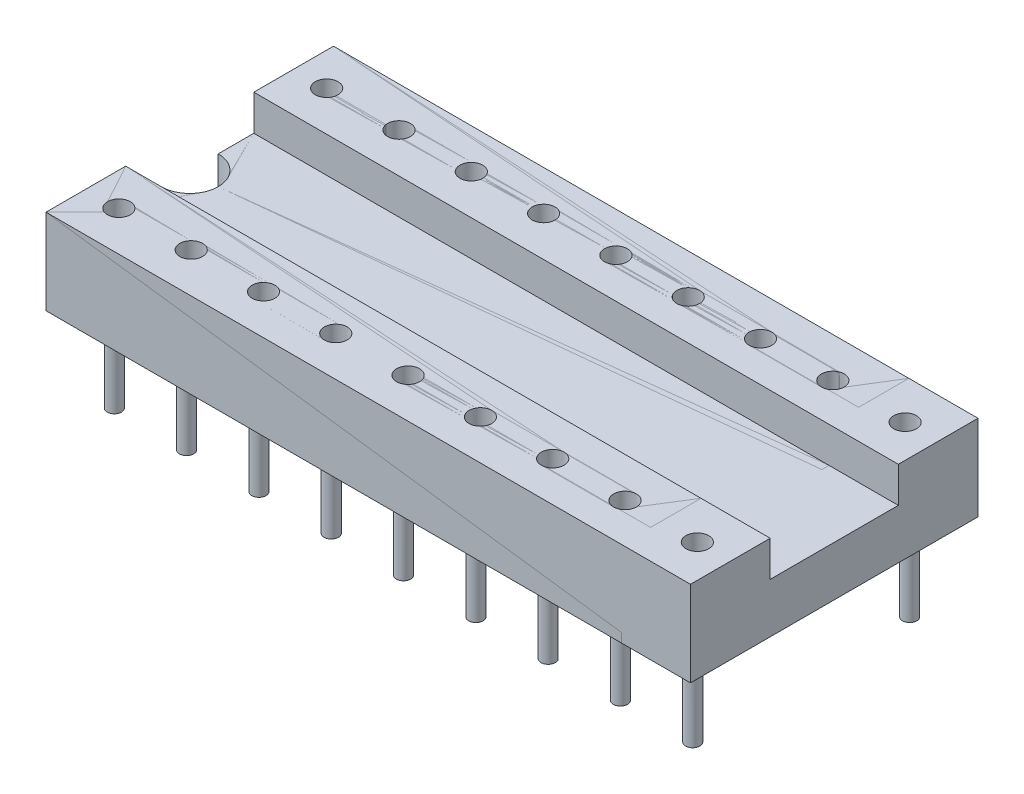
SolidWorks part; units mm, degrees
ref_plane "Plan de face" through (0, 0, 0) normal (0, 0, 1) x (1, 0, 0)
ref_plane "Plan de dessus" through (0, 0, 0) normal (0, 1, 0) x (1, 0, 0)
ref_plane "Plan de droite" through (0, 0, 0) normal (1, 0, 0) x (0, 0, -1)
imported_body "Importée1"
sketch "Esquisse1" plane through (0, 3, 0) normal (0, 1, 0) x (-1, 0, 0)
  line L1 (-23.2689, -6.8222) -> (-20.21, -6.8222)
  line L2 (-23.2689, -6.8222) -> (-23.2689, 5.9367)
  line L3 (-23.2689, 5.9367) -> (-20.21, 5.9367)
  line L4 (-20.21, -6.8222) -> (-20.21, 5.9367)
  circle A0 centre (-18.94, 3.65) radius 0.4 construction
  dimension "D1" = 1.27
extrude "Enlèv. mat.-Extru.1" cut sketch "Esquisse1" against normal through all
